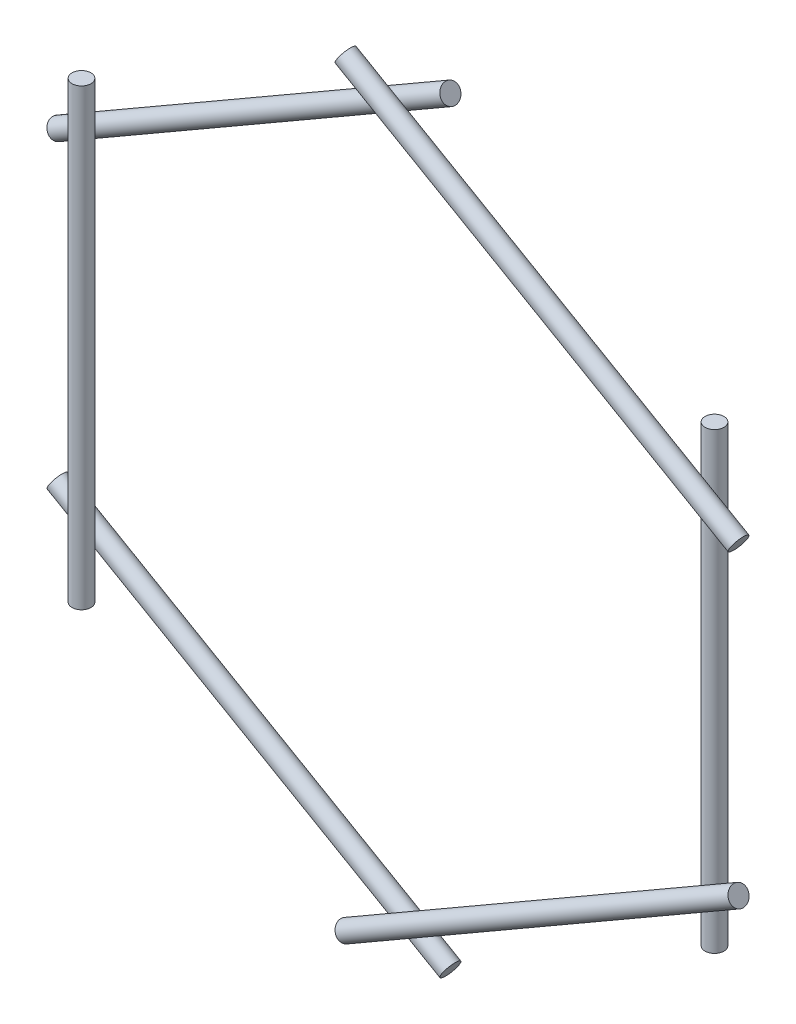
SolidWorks part; units mm, degrees
ref_plane "Front Plane" through (0, 0, 0) normal (1, 0, 0) x (0, 1, 0)
ref_plane "Top Plane" through (0, 0, 0) normal (0, 0, 1) x (0, 1, 0)
ref_plane "Right Plane" through (0, 0, 0) normal (0, 1, 0) x (-1, 0, 0)
sketch "Hex 6in Beam" plane through (0, 0, 0) normal (0, 0, 1) x (0, 1, 0)
  point P0 (0, -206.2815)
  point P1 (178.6451, -103.1408)
  point P2 (-178.6451, 103.1408)
  point P3 (178.6451, 103.1408)
  point P4 (-178.6451, -103.1408)
  point P7 (0, 206.2815)
  line B0 (76.2, 76.2) -> (215.5261, 215.5261) construction
  line B1 (-76.2, 76.2) -> (76.2, 76.2) construction
  line B2 (-76.2, 76.2) -> (-76.2, -76.2) construction
  line B3 (-76.2, -76.2) -> (76.2, -76.2) construction
  line B4 (76.2, 76.2) -> (76.2, -76.2) construction
  line B5 (-76.2, 76.2) -> (76.2, -76.2) construction
  line B6 (-76.2, -76.2) -> (76.2, 76.2) construction
  line B7 (238.1934, 0) -> (119.0967, 206.2815)
  line B8 (119.0967, 206.2815) -> (-119.0967, 206.2815)
  line B9 (-119.0967, 206.2815) -> (-238.1934, 0)
  line B10 (-238.1934, 0) -> (-119.0967, -206.2815)
  line B11 (-119.0967, -206.2815) -> (119.0967, -206.2815)
  line B12 (119.0967, -206.2815) -> (238.1934, 0)
  circle B13 centre (0, 0) radius 206.2815 construction
sketch_block_instance "Blk 6in Hex-1"
sketch_block "Blk 6in Hex" parameters "D1"=152.4, "D2"=152.4
sketch "Sketch2" plane through (0, 0, 0) normal (0, 1, 0) x (-1, 0, 0)
  circle A0 centre (-206.2815, -6.35) radius 6.35
  circle A1 centre (206.2815, 6.35) radius 6.35
  point P2 (206.2815, 0)
  point P6 (-206.2815, 0)
  dimension "D1" = 12.7
  dimension "D2" = 12.7
extrude "Boss-Extrude1" add sketch "Sketch2" along normal mid plane 304.8
sketch "Axis" plane through (0, 0, 0) normal (1, 0, 0) x (0, 1, 0)
  line L0 (0, 0) -> (0, 25)
  point P4 (0, 25)
ref_plane "n60deg Diag Plane" through (0, 0, 0) normal (-0.866, 0.5, 0) x (0, 0, 1)
sketch "Sketch4" plane through (0, 0, 0) normal (-0.866, 0.5, 0) x (0, 0, 1)
  circle A0 centre (6.35, 206.2815) radius 6.35
  circle A1 centre (-6.35, -206.2815) radius 6.35
  point P3 (0, 206.2815)
  point P11 (0, -206.2815)
  dimension "D1" = 12.7
  dimension "D2" = 12.7
extrude "Boss-Extrude2" add sketch "Sketch4" along normal mid plane 304.8 separate body
ref_plane "60deg diag plane" through (0, 0, 0) normal (-0.866, -0.5, 0) x (0, 0, 1)
sketch "Sketch5" plane through (0, 0, 0) normal (-0.866, -0.5, 0) x (0, 0, 1)
  circle A0 centre (-6.35, 206.2815) radius 6.35
  circle A1 centre (6.35, -206.2815) radius 6.35
  point P2 (0, 206.2815)
  point P6 (0, -206.2815)
  dimension "D1" = 12.7
  dimension "D2" = 12.7
extrude "Boss-Extrude3" add sketch "Sketch5" along normal mid plane 304.8 separate body
